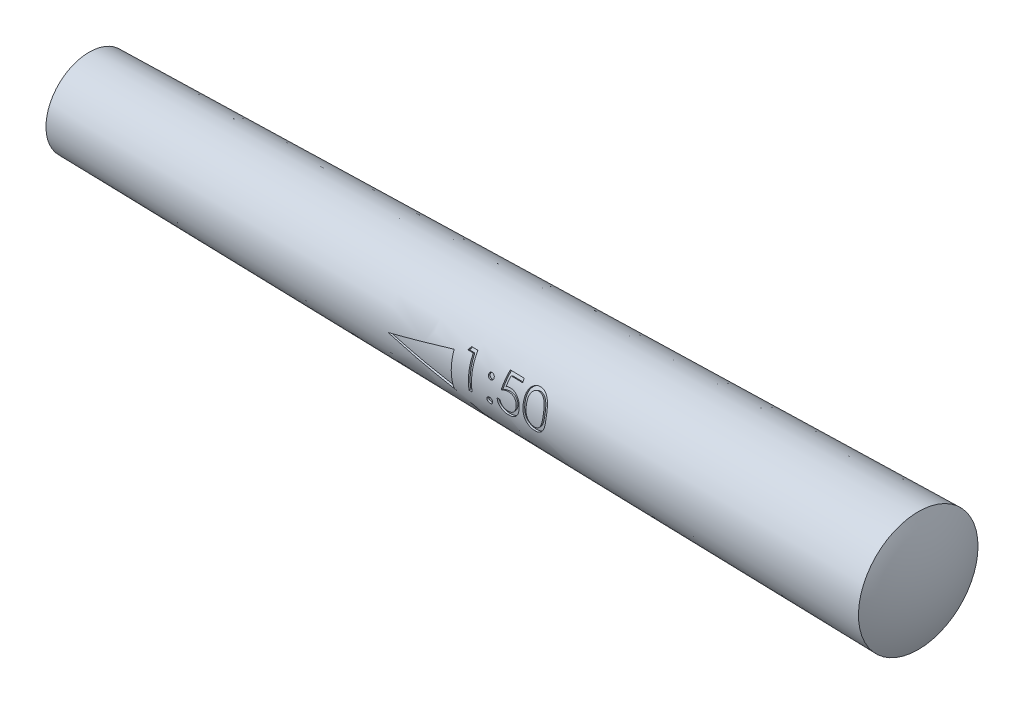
SolidWorks part; units mm, degrees
ref_plane "Front Plane" through (0, 0, 0) normal (0, 0, 1) x (1, 0, 0)
ref_plane "Top Plane" through (0, 0, 0) normal (0, 1, 0) x (1, 0, 0)
ref_plane "Right Plane" through (0, 0, 0) normal (1, 0, 0) x (0, 0, -1)
sketch "Sketch1" plane through (0, 0, 0) normal (1, 0, 0) x (0, 0, -1)
  circle A0 centre (0, 0) radius 1.25
  dimension "D1" = 2.5
extrude "Extrude1" add sketch "Sketch1" along normal mid plane 24
draft "Draft1" type of draft neutral plane draft angle 1.146 faces to draft 1 parameters "D1"=1.146
sketch "Sketch2" plane through (0, 0, 0) normal (0, 0, 1) x (1, 0, 0)
  line L0 (-12, 0) -> (-12, 1.25)
  line L1 (-12, 1.25) -> (-12, -1.25) construction
  line L2 (-12, 0) -> (-12.4, 0)
  line L3 (-12.4, 0) -> (-12.4, -1.49) construction
  line L4 (12, 0) -> (12, 1.73)
  line L5 (12, -1.73) -> (12, 1.73) construction
  line L6 (12, 0) -> (12.4, 0)
  line L7 (12.4, 0) -> (12.4, -1.49) construction
  line L8 (-12, -1.25) -> (12, -1.73) construction
  arc A0 (-12.4, 0) -> (-12, 1.25) centre (-10.2469, 0) cw
  arc A1 (12.4, 0) -> (12, 1.73) centre (8.4588, 0) ccw
  point P14 (0, -1.49)
revolve "Revolve1" add sketch "Sketch2" angle 360 about L2
sketch "Sketch5" plane through (0, 0, 0) normal (0, 0, 1) x (1, 0, 0)
  line L0 (0, 1.49) -> (0, -1.49) construction
  line L1 (12, 1.73) -> (-12, 1.25) construction
  line L2 (-12, -1.25) -> (12, -1.73) construction
ref_plane "Plane2" through (0, 0, 0) normal (-0.02, 0, 0.9998) x (0.9998, 0, 0.02)
sketch "Sketch6" plane through (0, 0, 0) normal (-0.02, 0, 0.9998) x (0.9998, 0, 0.02)
  line L0 (0, 0) -> (0, 0.5)
  line L1 (0, 1.49) -> (0, -1.49) construction
  line L2 (0, 0.5) -> (-1.866, 0)
  line L3 (-1.866, 0) -> (0, -0.5)
  line L4 (0, -0.5) -> (0, 0)
  line L5 (0, -0.25) -> (3, -0.25) construction
  text T0 "1:50" font "Century Gothic" height 1
  dimension "D1" = 1
  dimension "D2" = 30
  dimension "D3" = 3
wrap "Wrap2" sketch "Sketch6" wrap type deboss source sketch "Sketch6" thickness 0.05 parameters "D1"=0.05
equation "\"D2@Sketch2\" = \"D1@Sketch2\""
